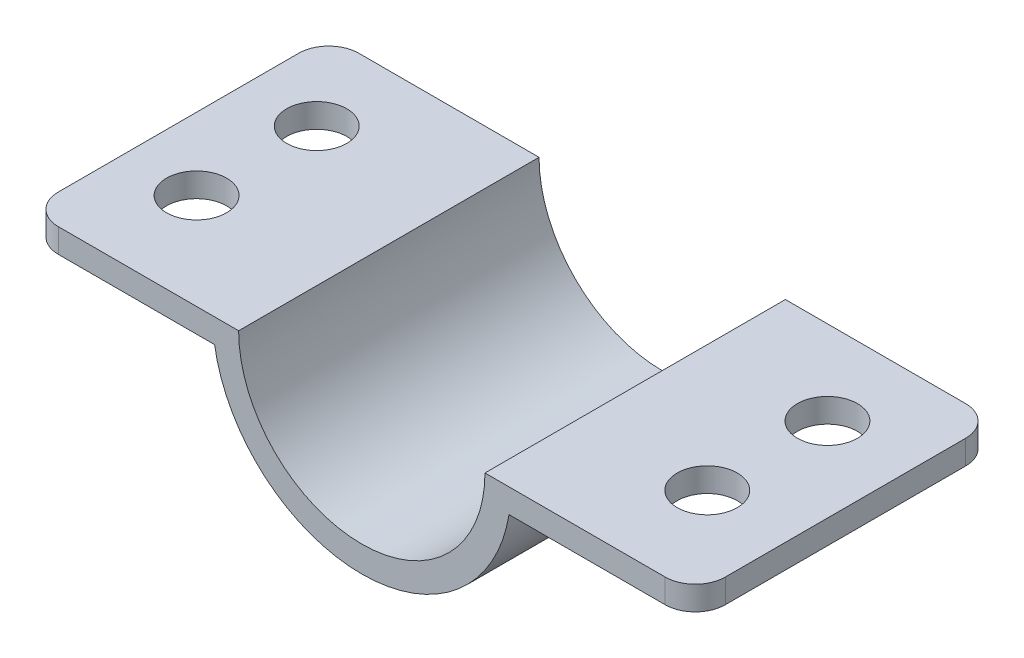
SolidWorks part; units mm, degrees
ref_plane "Front" through (0, 0, 0) normal (0, 0, 1) x (1, 0, 0)
ref_plane "Top" through (0, 0, 0) normal (0, 1, 0) x (1, 0, 0)
ref_plane "Right" through (0, 0, 0) normal (1, 0, 0) x (0, 0, -1)
sketch "Sketch1" plane through (0, 0, 0) normal (0, 0, 1) x (1, 0, 0)
  line L0 (-27.75, 0) -> (-10.25, 0)
  line L1 (10.25, 0) -> (27.75, 0)
  line L2 (-27.75, 0) -> (-27.75, -2)
  line L3 (-27.75, -2) -> (-12.25, -2)
  line L4 (27.75, 0) -> (27.75, -2)
  line L5 (27.75, -2) -> (12.25, -2)
  arc A0 (-10.25, 0) -> (10.25, 0) centre (0, 0) ccw
  arc A1 (-12.25, -2) -> (12.25, -2) centre (0, 0) ccw
  dimension "D1" = 10.25
  dimension "D3" = 15.5
  dimension "D2" = 2
  dimension "D4" = 17.5
extrude "Boss-Extrude1" add sketch "Sketch1" along normal mid plane 25
hole_wizard "Ø5.0 (5) Diameter Hole2" positions "Sketch12" profile "Sketch13" hole size "Ø5.0" standard "ISO"
sketch "Sketch12" plane through (0, 0, 0) normal (0, 1, 0) x (1, 0, 0)
  line L0 (-10.25, 12.5) -> (-27.75, 12.5) construction
  line L1 (-27.75, -12.5) -> (-27.75, 12.5) construction
  point P0 (-21.75, 5.5)
  dimension "D1" = 7
  dimension "D2" = 6
sketch "Sketch13" plane through (-21.75, 0, -5.5) normal (1, 0, 0) x (0, 0, 1)
  line L0 (0, 0) -> (0, 11.5022)
  line L1 (0, 11.5022) -> (2.5, 10)
  line L2 (2.5, 10) -> (2.5, 0)
  line L5 (2.5, 0) -> (0, 0)
  line L10 (0, 11.5022) -> (-2.5, 10) construction
  line L11 (0, -6.35) -> (0, 107.95) construction
  dimension "Hole Dia." = 5
  dimension "Hole Depth" = 10
  dimension "Drill Angle" = 118
pattern_linear "LPattern1" count 2 spacing 10 along (0, 0, 1) of "Ø5.0 (5) Diameter Hole2"
hole_wizard "Ø5.0 (5) Diameter Hole3" positions "Sketch16" profile "Sketch17" hole size "Ø5.0" standard "ISO"
sketch "Sketch16" plane through (0, 0, 0) normal (0, 1, 0) x (1, 0, 0)
  line L0 (27.75, 12.5) -> (10.25, 12.5) construction
  line L1 (27.75, -12.5) -> (27.75, 12.5) construction
  point P0 (20.75, 5.5)
  dimension "D1" = 7
  dimension "D2" = 7
sketch "Sketch17" plane through (20.75, 0, -5.5) normal (1, 0, 0) x (0, 0, 1)
  line L0 (0, 0) -> (0, 11.5022)
  line L1 (0, 11.5022) -> (2.5, 10)
  line L2 (2.5, 10) -> (2.5, 0)
  line L5 (2.5, 0) -> (0, 0)
  line L10 (0, 11.5022) -> (-2.5, 10) construction
  line L11 (0, -6.35) -> (0, 107.95) construction
  dimension "Hole Dia." = 5
  dimension "Hole Depth" = 10
  dimension "Drill Angle" = 118
pattern_linear "LPattern2" count 2 spacing 10 along (0, 0, 1) of "Ø5.0 (5) Diameter Hole3"
fillet "Fillet1" radius 2.5 4 edges at (27.75, -1, 12.5) (27.75, -1, -12.5) (-27.75, -1, 12.5) (-27.75, -1, -12.5)
